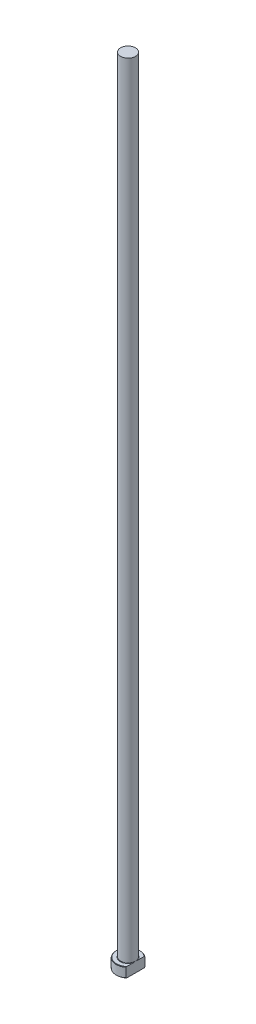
SolidWorks part; units mm, degrees
ref_plane "Front Plane" through (0, 0, 0) normal (0, 0, 1) x (1, 0, 0)
ref_plane "Top Plane" through (0, 0, 0) normal (0, 1, 0) x (1, 0, 0)
ref_plane "Right Plane" through (0, 0, 0) normal (1, 0, 0) x (0, 0, -1)
sketch "Sketch1" plane through (0, 0, 0) normal (0, 0, 1) x (1, 0, 0)
  line L0 (0, 259.9588) -> (0, -15.1925) construction
  line L1 (0, 0) -> (-6, 0)
  line L2 (-6, 0) -> (-6, 5)
  line L3 (-6, 5) -> (-3.75, 5)
  line L4 (-3.75, 5) -> (-3.75, 400)
  line L5 (-3.75, 400) -> (0, 400)
  line L6 (0, 400) -> (0, 0)
  dimension "L" = 400
  dimension "H" = 12
  dimension "T" = 5
  dimension "D" = 7.5
revolve "Revolve1" add sketch "Sketch1" angle 360 about L0
chamfer "Chamfer1" distance 0.2 angle 45 2 edges at (0, 5, 6) (0, 0, 6)
fillet "Fillet1" radius 0.2 1 edges at (0, 5, 3.75)
sketch "Sketch2" plane through (0, 0, 0) normal (0, 1, 0) x (1, 0, 0)
  line L0 (3.75, 4.6837) -> (3.75, -4.6837)
  circle A0 centre (0, 0) radius 6 construction
  arc A1 (3.75, -4.6837) -> (3.75, 4.6837) centre (0, 0) ccw
  circle A2 centre (0, 0) radius 3.75 construction
extrude "KEY" cut sketch "Sketch2" along normal through all
